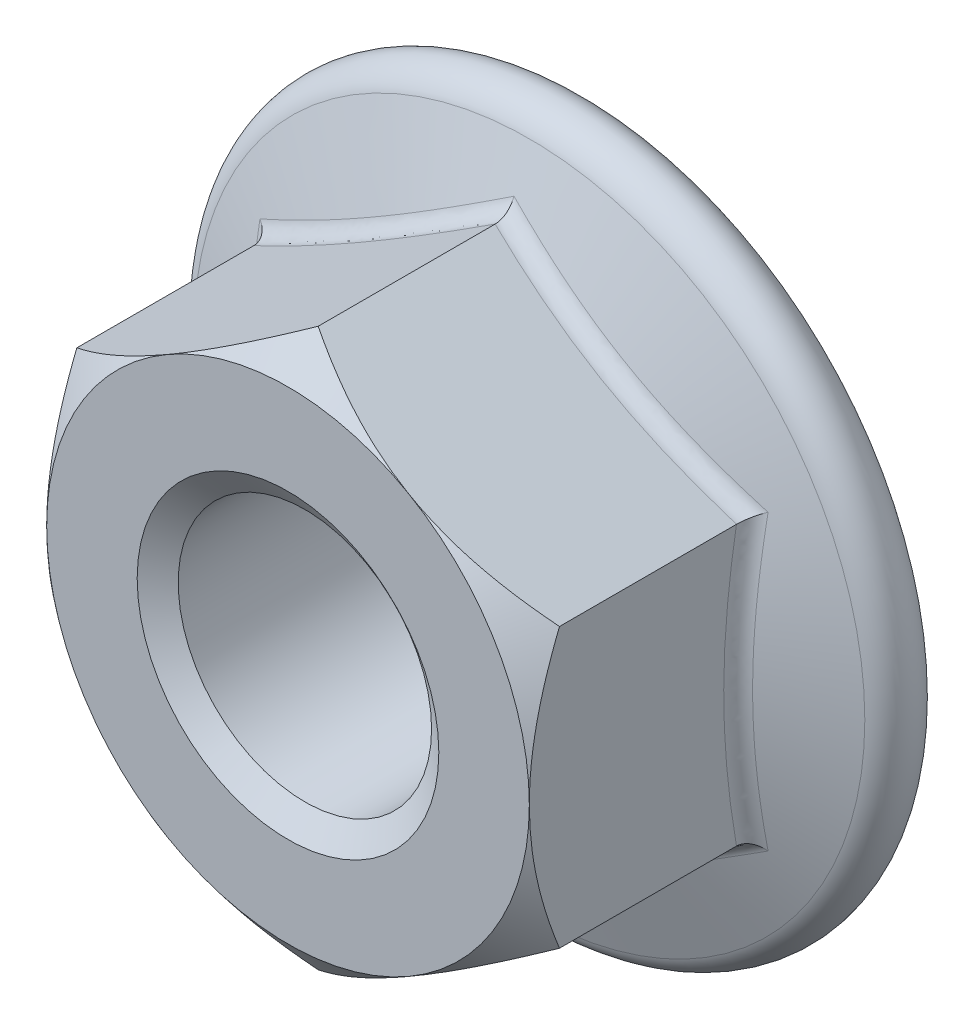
SolidWorks part; units mm, degrees
ref_plane "Plane1" through (0, 0, 0) normal (0, 0, 1) x (1, 0, 0)
ref_plane "Plane2" through (0, 0, 0) normal (0, 1, 0) x (1, 0, 0)
ref_plane "Plane3" through (0, 0, 0) normal (1, 0, 0) x (0, 0, -1)
revolve "EndChamfer" cut sketch "Sketch5"
sketch "Sketch5"
  line L0 (4.9746, 2.5) -> (4.6665, 2.06)
  line L1 (5.0254, 2.5) -> (4.9746, 2.5)
  line L2 (5.0254, 2.5) -> (5.0254, 2.06)
  line L3 (5.0254, 2.06) -> (4.6665, 2.06)
  line L6 (-0.0508, 2.5) -> (0, 2.5)
  line L7 (0, 2.5) -> (0.3081, 2.06)
  line L9 (0.3081, 2.06) -> (-0.0508, 2.06)
  line L10 (-0.0508, 2.06) -> (-0.0508, 2.5)
  line L11 (25.0375, 0) -> (38.388, 0) construction
  line L12 (5, 0) -> (0, 0) construction
extrude "BaseNut" add sketch "BaseNutSke" against normal blind 5
sketch "BaseNutSke" plane through (0, 0, 0) normal (0, 0, 1) x (1, 0, 0)
  line L6 (4, 2.3094) -> (4, -2.3094)
  line L7 (-4, 2.3094) -> (-4, -2.3094)
  line L8 (4, 2.3094) -> (0, 4.6188)
  line L9 (0, 4.6188) -> (-4, 2.3094)
  line L10 (-4, -2.3094) -> (0, -4.6188)
  line L11 (0, -4.6188) -> (4, -2.3094)
  circle A0 centre (0, 0) radius 2.1
  dimension "D4" = 4
  dimension "Tap_drill" = 4.2
  dimension "D1" = 120
  dimension "D2" = 4
  dimension "D3" = 4
  dimension "Width_flats" = 8
pattern_linear "ThdSchPat" [suppressed]
revolve "ThreadSchematic" cut sketch "ThdSchSke" angle 360 about L11
sketch "ThdSchSke" plane through (0, 0, 0) normal (0, 1, 0) x (1, 0, 0)
  line L0 (-2.5, 0.0254) -> (-2.1, 0.3055)
  line L1 (-2.1, 0.3055) -> (-1.05, 0.3055)
  line L2 (-1.05, 0.3055) -> (-1.05, -0.2547)
  line L3 (-1.05, -0.2547) -> (-2.1, -0.2547)
  line L4 (-2.1, -0.2547) -> (-2.5, 0.0254)
  line L5 (-3.175, 0.8) -> (3.175, 0.8) construction
  line L6 (0, 0.8) -> (0, -2.9874) construction
  line L7 (0, 4.6945) -> (0, 0.2801) construction
  dimension "D1" = 35
  dimension "VeeAngle" = 70
  dimension "SideAngle" = 55
  dimension "D2" = 0.0508
  dimension "OverCut" = 2.1
  dimension "Tap_Drill" = 4.2
  dimension "Advance" = 0.707
  dimension "Thread_major" = 5
  dimension "Num_threads" = 8
  dimension "D4" = 50
  dimension "Offset1" = 5.0254
  dimension "ThreadMajor" = 2.5
  dimension "ChamferDepth" = 0.44
  dimension "Offset2" = 5.0762
sketch "Sketch6" plane through (0, 0, 0) normal (1, 0, 0) x (0, 0, -1)
  line L0 (2.7404, 2.1) -> (4, 5.5608)
  line L1 (5, 2.1) -> (5, 5.3845)
  line L2 (4, 32.2909) -> (4, 5.5608) construction
  line L3 (23.7075, 5.9) -> (19.5103, 5.9) construction
  line L4 (5, 2.1) -> (2.7404, 2.1)
  line L5 (23.7075, -5.9) -> (19.5103, -5.9) construction
  line L6 (5, 2.3094) -> (5, 4.6188) construction
  line L7 (0, 0) -> (32.9582, 0) construction
  line L8 (5, -2.1) -> (2.7404, -2.1) construction
  line L9 (5, 0) -> (0, 0) construction
  arc A0 (5, 5.3845) -> (4, 5.5608) centre (4.4845, 5.3845) ccw
  dimension "D1" = 4.2
  dimension "D2" = 20
  dimension "Flange_dia" = 11.8
  dimension "Flange_thickness" = 1
revolve "Flange" add sketch "Sketch6" angle 360 about L7
sketch "Sketch3" plane through (0, 0, 0) normal (1, 0, 0) x (0, 0, -1)
  line L0 (5, 4) -> (4.5, 4.6188) construction
  line L1 (4.5, 4.6188) -> (4.5, 17.3188) construction
  line L2 (4.5, 17.3188) -> (17.7, 17.3188) construction
  line L3 (17.7, 17.3188) -> (17.7, 4) construction
  line L4 (17.7, 4) -> (5, 4) construction
  line L5 (5, 2.3094) -> (5, 4.6188) construction
  line L6 (3.6571, 4.6188) -> (0, 4.6188) construction
  line L7 (0, 0) -> (38.6776, 0) construction
  line L8 (5, 0) -> (0, 0) construction
  line L9 (2.5, 4.6188) -> (2.5, 44.222) construction
  line L10 (0.5, 17.3188) -> (-12.7, 17.3188)
  line L11 (-12.7, 17.3188) -> (-12.7, 4)
  line L12 (-12.7, 4) -> (0, 4)
  line L13 (0, 4) -> (0.5, 4.6188)
  line L14 (0.5, 4.6188) -> (0.5, 17.3188)
  line L16 (3.6571, 4.6188) -> (0, 4.6188) construction
  dimension "D1" = 4
  dimension "D2" = 0.5
  dimension "D3" = 12.7
  dimension "D4" = 12.7
  dimension "D5" = 2.5
revolve "Double-Chamfer" cut sketch "Sketch3" angle 360 about L7
fillet "FlangeFillet" radius 0.3 6 edges
equation "\"D2@BaseNutSke\" = \"Width_flats@BaseNutSke\" / 2"
equation "\"D3@BaseNutSke\" = \"Width_flats@BaseNutSke\" / 2"
equation "\"D1@Sketch3\" = \"Width_flats@BaseNutSke\" /2"
equation "\"D2@Sketch3\" = \"Thread_major@ThreadCosmetic\" *.1"
equation "\"D4@BaseNutSke\" = \"D3@BaseNutSke\""
equation "\"Thread_major@ThdSchSke\" = \"Thread_major@ThreadCosmetic\""
equation "\"Tap_drill@ThdSchSke\" = \"Tap_drill@BaseNutSke\""
equation "\"Overcut@ThdSchSke\" = \"Tap_drill@ThdSchSke\" * 0.5"
equation "\"Num_threads@ThdSchPat\" = int(  ( \"Thickness@BaseNut\" - 0.0508 ) / \"Advance@ThdSchSke\" + 0.999 )  + 1"
equation "\"Advance@ThdSchPat\" = ( \"Thickness@BaseNut\" - 0.0508 ) /  (\"Num_threads@ThdSchPat\" - 1) 'relax it"
equation "' \"Num_threads@ThdSchPat\" = \"Num_threads@ThdSchPat\" - sgn( \"Num_threads@ThdSchPat\" - 1) '---chamfered tips only---"
equation "\"ThreadMajor@Sketch5\" = \"Thread_major@ThreadCosmetic\" * 0.5"
equation "\"ChamferDepth@Sketch5\" = (\"Thread_major@ThreadCosmetic\" - \"Tap_drill@BaseNutSke\") * 0.55"
equation "\"Offset1@Sketch5\" = \"Thickness@BaseNut\" + 0.0254"
equation "\"Offset2@Sketch5\" = \"Offset1@Sketch5\" + 0.0508"
equation "\"D1@Sketch6\" = \"Tap_drill@BaseNutSke\""
equation "\"D5@Sketch3\" = \"Thickness@BaseNut\" / 2"
